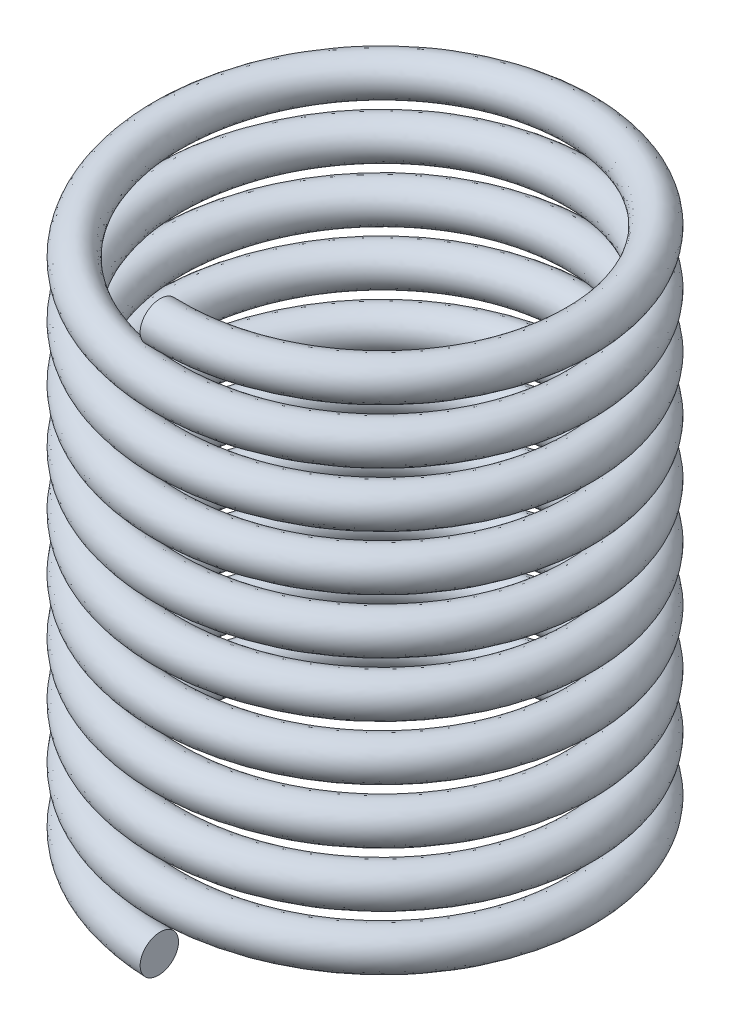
SolidWorks part; units mm, degrees
ref_plane "Front Plane" through (0, 0, 0) normal (0, 0, 1) x (1, 0, 0)
ref_plane "Top Plane" through (0, 0, 0) normal (0, 1, 0) x (1, 0, 0)
ref_plane "Right Plane" through (0, 0, 0) normal (1, 0, 0) x (0, 0, -1)
sketch "Sketch1" plane through (0, 0, 0) normal (0, 1, 0) x (1, 0, 0)
  circle A0 centre (0, 0) radius 37.5
  dimension "D1" = 75
curve "Helix/Spiral1"
ref_plane "Plane1" through (0, 0, 37.5) normal (-0.9991, 0.0424, 0) x (0, 0, 1)
sketch "Sketch2" plane through (0, 0, 37.5) normal (-0.9991, 0.0424, 0) x (0, 0, 1)
  circle A0 centre (0, 0) radius 3.5
  dimension "D1" = 7
sweep "Sweep1" add profiles "Sketch2" path "Helix/Spiral1"
